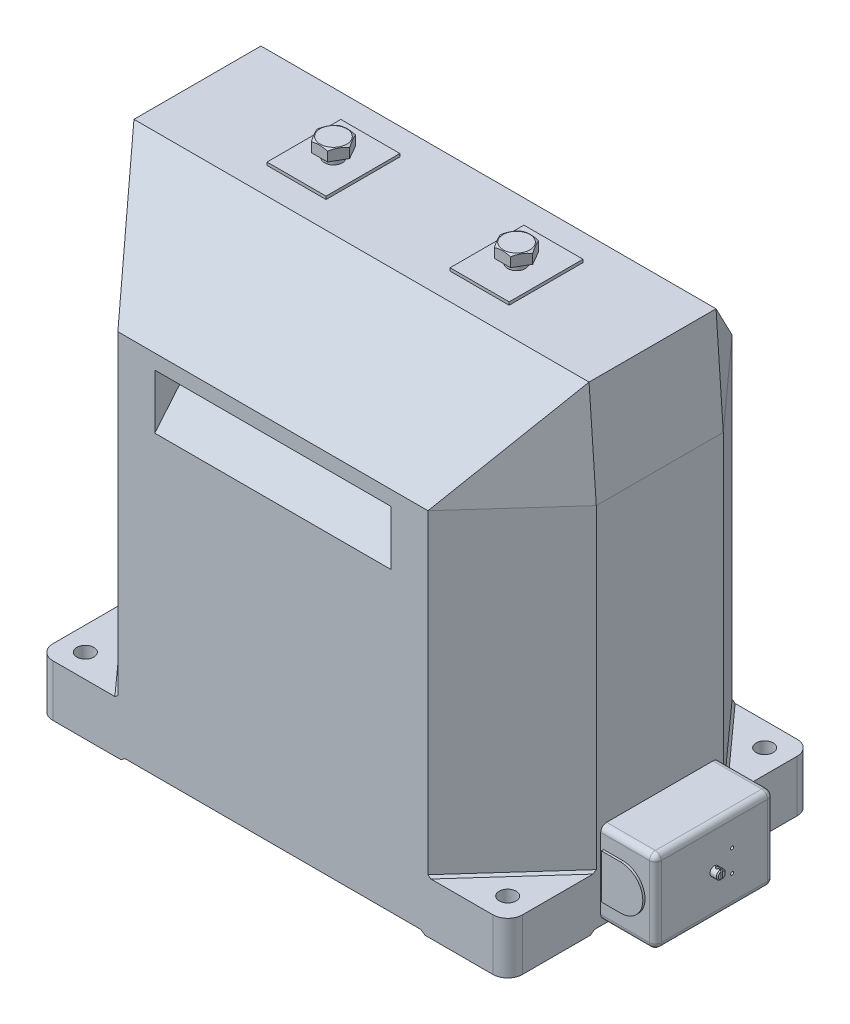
SolidWorks part; units mm, degrees
ref_plane "Front Plane" through (0, 0, 0) normal (0, 0, 1) x (1, 0, 0)
ref_plane "Top Plane" through (0, 0, 0) normal (0, 1, 0) x (1, 0, 0)
ref_plane "Right Plane" through (0, 0, 0) normal (1, 0, 0) x (0, 0, -1)
other "Join1"
other "HlTmCsDIN933<1>@24305_AM-40a_Körvonalrajzhoz"
other "HlTmCsDIN933<2>@24305_AM-40a_Körvonalrajzhoz"
other "HlTmCsDIN933<3>@24305_AM-40a_Körvonalrajzhoz"
other "FME12_Tömszelence_29519_112<1>@24305_AM-40a_Körvonalrajzhoz"
other "FME12_TRA_Kapocsfedél_29519_113<1>@24305_AM-40a_Körvonalrajzhoz"
other "21105-115_PlombaCsavar<1>@24305_AM-40a_Körvonalrajzhoz"
other "FME12_Tömszelence_29519_112<2>@24305_AM-40a_Körvonalrajzhoz"
other "AM40a_TRA_Kiöntött_Körvonalrajzhoz<1>@24305_AM-40a_Körvonalrajzhoz/AM40a_TRA_Test_T24305<1>@AM40a_TRA_Kiöntött_Körvonalrajzhoz"
